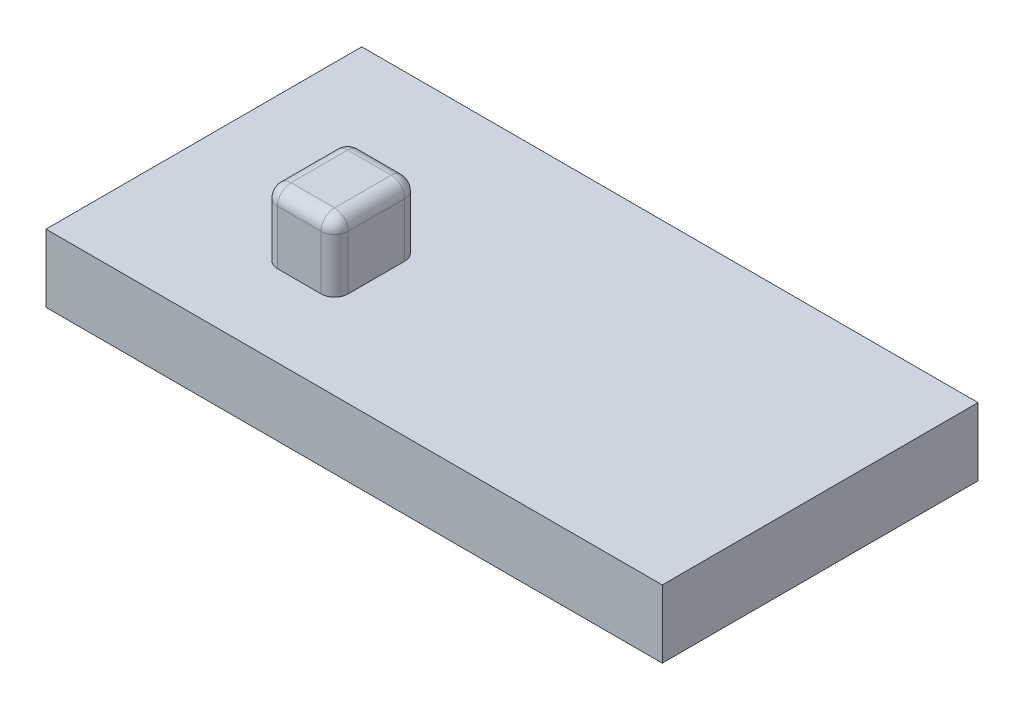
SolidWorks part; units mm, degrees
ref_plane "Front Plane" through (0, 0, 0) normal (0, 0, 1) x (1, 0, 0)
ref_plane "Top Plane" through (0, 0, 0) normal (0, 1, 0) x (1, 0, 0)
ref_plane "Right Plane" through (0, 0, 0) normal (1, 0, 0) x (0, 0, -1)
sketch "Sketch1" plane through (0, 0, 0) normal (0, 1, 0) x (1, 0, 0)
  line L1 (-64.2407, 31.4854) -> (26.6815, 31.4854)
  line L2 (-64.2407, 31.4854) -> (-64.2407, -15.1001)
  line L3 (-64.2407, -15.1001) -> (26.6815, -15.1001)
  line L4 (26.6815, 31.4854) -> (26.6815, -15.1001)
extrude "Extrude1" add sketch "Sketch1" along normal blind 10
sketch "Sketch2" plane through (0, 10, 0) normal (0, 1, 0) x (1, 0, 0)
  line L1 (-44.0997, 9.2541) -> (-33.6739, 9.2541)
  line L2 (-44.0997, 9.2541) -> (-44.0997, -3.0863)
  line L3 (-44.0997, -3.0863) -> (-33.6739, -3.0863)
  line L4 (-33.6739, 9.2541) -> (-33.6739, -3.0863)
extrude "Extrude2" add sketch "Sketch2" along normal blind 10
fillet "Fillet1" radius 2 8 edges at (-44.0997, 20, -3.0839) (-33.6739, 20, -3.0839) (-38.8868, 20, -9.2541) (-44.0997, 15, -9.2541) (-33.6739, 15, -9.2541) (-33.6739, 15, 3.0863) (-44.0997, 15, 3.0863) (-38.8868, 20, 3.0863)
